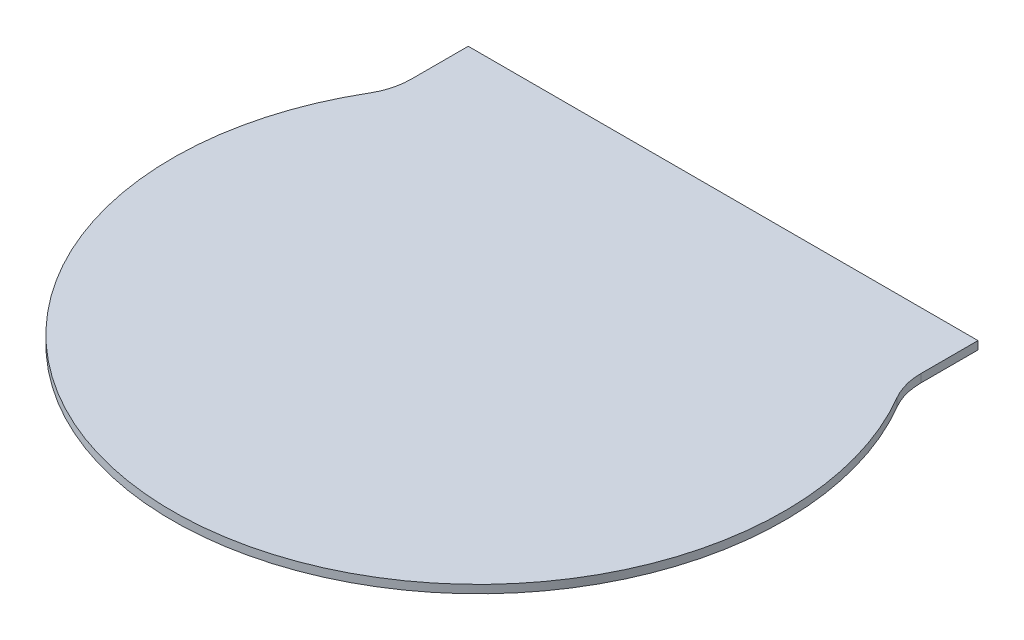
SolidWorks part; units mm, degrees
ref_plane "Front Plane" through (0, 0, 0) normal (0, 0, 1) x (1, 0, 0)
ref_plane "Top Plane" through (0, 0, 0) normal (0, 1, 0) x (1, 0, 0)
ref_plane "Right Plane" through (0, 0, 0) normal (1, 0, 0) x (0, 0, -1)
sketch "Sketch1" plane through (0, 0, 0) normal (0, 1, 0) x (1, 0, 0)
  line L0 (3.175, 3.048) -> (-3.175, 3.048)
  line L1 (-3.175, 2.3383) -> (-3.175, 3.048)
  line L2 (3.175, 2.3383) -> (3.175, 3.048)
  arc A0 (-3.2866, 1.9272) -> (3.2866, 1.9272) centre (0, 0) ccw
  arc A1 (-3.2866, 1.9272) -> (-3.175, 2.3383) centre (-3.9878, 2.3383) ccw
  arc A2 (-3.2866, 1.9272) -> (-3.175, 2.3383) centre (-3.9878, 2.3383) ccw
  arc A3 (3.175, 2.3383) -> (3.2866, 1.9272) centre (3.9878, 2.3383) ccw
extrude "Extrude1" add sketch "Sketch1" along normal blind 0.1016 contours A3 L2 L0 L1 A1 A0
